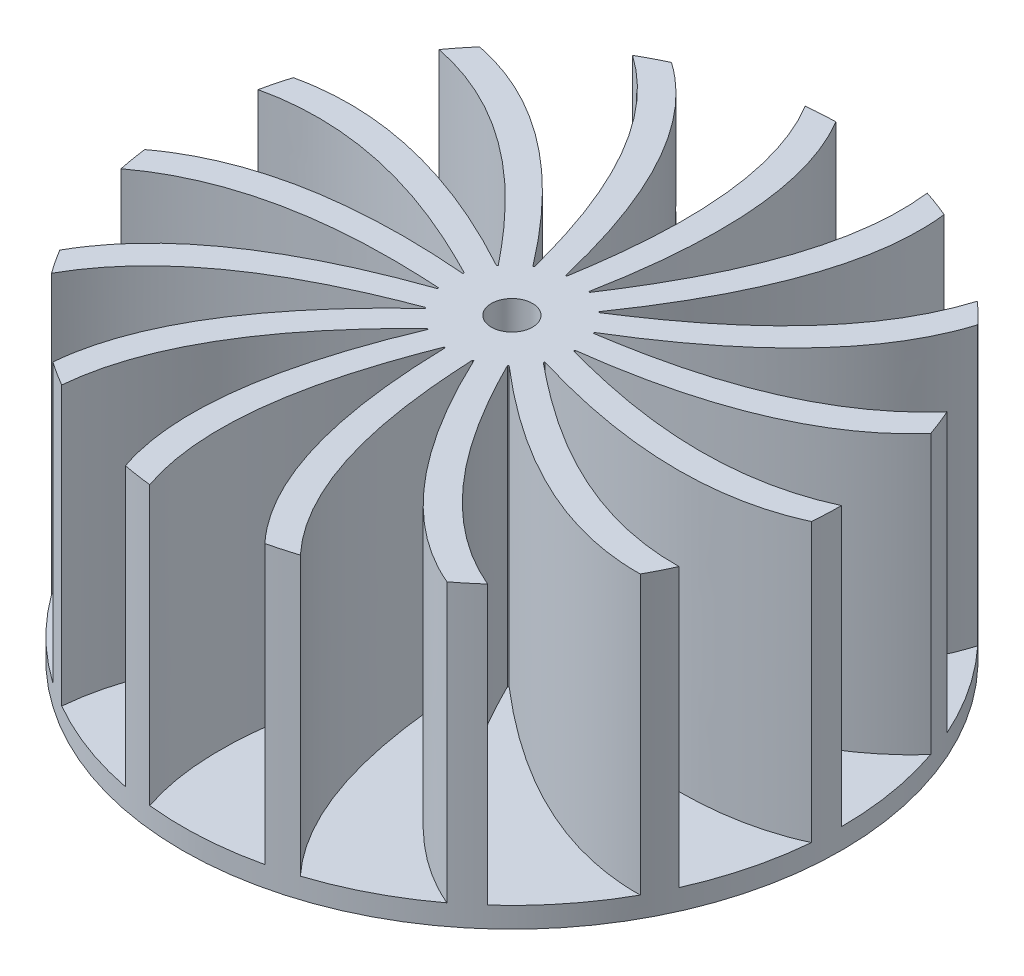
SolidWorks part; units mm, degrees
ref_plane "Front Plane" through (0, 0, 0) normal (0, 0, 1) x (1, 0, 0)
ref_plane "Top Plane" through (0, 0, 0) normal (0, 1, 0) x (1, 0, 0)
ref_plane "Right Plane" through (0, 0, 0) normal (1, 0, 0) x (0, 0, -1)
sketch "Sketch1" plane through (0, 0, 0) normal (0, 1, 0) x (1, 0, 0)
  circle A0 centre (0, 0) radius 16
  dimension "D1" = 32
extrude "Boss-Extrude1" add sketch "Sketch1" along normal blind 1
sketch "Sketch2" plane through (0, 1, 0) normal (0, 1, 0) x (1, 0, 0)
  circle A0 centre (0, 0) radius 3
  circle A1 centre (0, 0) radius 1.5
  dimension "D1" = 6
  dimension "D2" = 3
extrude "Boss-Extrude2" add sketch "Sketch2" along normal blind 13.5 contours A0
sketch "Sketch4" plane through (0, 1, 0) normal (0, 1, 0) x (1, 0, 0)
  line L0 (-0.55, 0) -> (0.55, 0) construction
  line L1 (19.6058, 1.6753) -> (12.3942, -1.6753) construction
  line L2 (19.856, 0.4207) -> (12.0572, -3.2028) construction
  circle A0 centre (0, 0) radius 3 construction
  circle A1 centre (0, 0) radius 3 construction
  circle A2 centre (0, 0) radius 16 construction
  arc A3 (16, 0) -> (15.9387, -1.3994) centre (0, 0) cw
  arc A4 (2.7645, -1.165) -> (3, 0) centre (0, 0) ccw
  arc A5 (2.0517, -2.1888) -> (2.7406, -1.2202) centre (0, 0) ccw
  arc A6 (14.6167, -6.5078) -> (13.9915, -7.7613) centre (0, 0) cw
  arc A7 (0.984, -2.834) -> (2.0074, -2.2294) centre (0, 0) ccw
  arc A8 (10.7061, -11.8903) -> (9.6251, -12.7811) centre (0, 0) cw
  arc A9 (-0.2537, -2.9893) -> (0.9271, -2.8532) centre (0, 0) ccw
  arc A10 (4.9443, -15.2169) -> (3.5944, -15.591) centre (0, 0) cw
  arc A11 (-1.4476, -2.6276) -> (-0.3136, -2.9836) centre (0, 0) ccw
  arc A12 (-1.6725, -15.9124) -> (-3.0578, -15.7051) centre (0, 0) cw
  arc A13 (-2.3912, -1.8116) -> (-1.5, -2.5981) centre (0, 0) ccw
  arc A14 (-8, -13.8564) -> (-9.1813, -13.1036) centre (0, 0) cw
  arc A15 (-2.9214, -0.6824) -> (-2.4271, -1.7634) centre (0, 0) ccw
  arc A16 (-12.9443, -9.4046) -> (-13.7172, -8.2364) centre (0, 0) cw
  arc A17 (-2.9464, 0.5648) -> (-2.9344, -0.6237) centre (0, 0) ccw
  arc A18 (-15.6504, -3.3266) -> (-15.8813, -1.945) centre (0, 0) cw
  arc A19 (-2.4619, 1.7144) -> (-2.9344, 0.6237) centre (0, 0) ccw
  arc A20 (-15.6504, 3.3266) -> (-15.2994, 4.6827) centre (0, 0) cw
  arc A21 (-1.5518, 2.5675) -> (-2.4271, 1.7634) centre (0, 0) ccw
  arc A22 (-12.9443, 9.4046) -> (-12.0721, 10.5007) centre (0, 0) cw
  arc A23 (-0.3733, 2.9767) -> (-1.5, 2.5981) centre (0, 0) ccw
  arc A24 (-8, 13.8564) -> (-6.7574, 14.503) centre (0, 0) cw
  arc A25 (0.8697, 2.8712) -> (-0.3136, 2.9836) centre (0, 0) ccw
  arc A26 (-1.6725, 15.9124) -> (-0.2743, 15.9976) centre (0, 0) cw
  arc A27 (1.9623, 2.2692) -> (0.9271, 2.8532) centre (0, 0) ccw
  arc A28 (4.9443, 15.2169) -> (6.2562, 14.7262) centre (0, 0) cw
  arc A29 (2.7156, 1.2749) -> (2.0074, 2.2294) centre (0, 0) ccw
  arc A30 (10.7061, 11.8903) -> (11.705, 10.9084) centre (0, 0) cw
  arc A31 (2.9994, 0.0601) -> (2.7406, 1.2202) centre (0, 0) ccw
  arc A32 (14.6167, 6.5078) -> (15.1299, 5.2044) centre (0, 0) cw
  spline S0 degree 3 poles (3, 0) (6.0429, -0.8283) (11.4927, -2.0942) (16, 0) knots 0 0 0 0 1 1 1 1
  spline S1 degree 2 poles (2.7645, -1.165) (11.0644, -3.664) (15.9387, -1.3994) knots 0 0 0 1 1 1
  spline S2 degree 3 poles (2.7406, -1.2202) (5.1835, -3.2146) (9.6473, -6.5876) (14.6167, -6.5078) knots 0 0 0 0 1 1 1 1
  spline S3 degree 2 poles (2.0517, -2.1888) (8.6176, -7.8476) (13.9915, -7.7613) knots 0 0 0 1 1 1
  spline S4 degree 3 poles (2.0074, -2.2294) (3.4279, -5.045) (6.1339, -9.942) (10.7061, -11.8903) knots 0 0 0 0 1 1 1 1
  spline S5 degree 2 poles (0.984, -2.834) (4.6806, -10.6742) (9.6251, -12.7811) knots 0 0 0 1 1 1
  spline S6 degree 3 poles (0.9271, -2.8532) (1.0796, -6.0031) (1.5598, -11.5773) (4.9443, -15.2169) knots 0 0 0 0 1 1 1 1
  spline S7 degree 2 poles (-0.2537, -2.9893) (-0.0656, -11.6552) (3.5944, -15.591) knots 0 0 0 1 1 1
  spline S8 degree 3 poles (-0.3136, -2.9836) (-1.4554, -5.9232) (-3.284, -11.2108) (-1.6725, -15.9124) knots 0 0 0 0 1 1 1 1
  spline S9 degree 2 poles (-1.4476, -2.6276) (-4.8005, -10.6208) (-3.0578, -15.7051) knots 0 0 0 1 1 1
  spline S10 degree 3 poles (-1.5, -2.5981) (-3.7388, -4.8191) (-7.56, -8.9059) (-8, -13.8564) knots 0 0 0 0 1 1 1 1
  spline S11 degree 2 poles (-2.3912, -1.8116) (-8.7054, -7.7501) (-9.1813, -13.1036) knots 0 0 0 1 1 1
  spline S12 degree 3 poles (-2.4271, -1.7634) (-5.3756, -2.8818) (-10.5287, -5.061) (-12.9443, -9.4046) knots 0 0 0 0 1 1 1 1
  spline S13 degree 2 poles (-2.9214, -0.6824) (-11.105, -3.5392) (-13.7172, -8.2364) knots 0 0 0 1 1 1
  spline S14 degree 3 poles (-2.9344, -0.6237) (-6.083, -0.4462) (-11.677, -0.3411) (-15.6504, -3.3266) knots 0 0 0 0 1 1 1 1
  spline S15 degree 2 poles (-2.9464, 0.5648) (-11.5845, 1.2836) (-15.8813, -1.945) knots 0 0 0 1 1 1
  spline S16 degree 3 poles (-2.9344, 0.6237) (-5.7386, 2.0666) (-10.8062, 4.4379) (-15.6504, 3.3266) knots 0 0 0 0 1 1 1 1
  spline S17 degree 2 poles (-2.4619, 1.7144) (-10.0609, 5.8844) (-15.2994, 4.6827) knots 0 0 0 1 1 1
  spline S18 degree 3 poles (-2.4271, 1.7634) (-4.4019, 4.222) (-8.0669, 8.4495) (-12.9443, 9.4046) knots 0 0 0 0 1 1 1 1
  spline S19 degree 2 poles (-1.5518, 2.5675) (-6.7976, 9.4678) (-12.0721, 10.5007) knots 0 0 0 1 1 1
  spline S20 degree 3 poles (-1.5, 2.5981) (-2.3041, 5.6474) (-3.9328, 11.0001) (-8, 13.8564) knots 0 0 0 0 1 1 1 1
  spline S21 degree 2 poles (-0.3733, 2.9767) (-2.3591, 11.4141) (-6.7574, 14.503) knots 0 0 0 1 1 1
  spline S22 degree 3 poles (-0.3136, 2.9836) (0.1921, 6.0963) (0.8814, 11.6486) (-1.6725, 15.9124) knots 0 0 0 0 1 1 1 1
  spline S23 degree 2 poles (0.8697, 2.8712) (2.4874, 11.3868) (-0.2743, 15.9976) knots 0 0 0 1 1 1
  spline S24 degree 3 poles (0.9271, 2.8532) (2.6551, 5.4911) (5.5431, 10.2831) (4.9443, 15.2169) knots 0 0 0 0 1 1 1 1
  spline S25 degree 2 poles (1.9623, 2.2692) (6.9038, 9.3907) (6.2562, 14.7262) knots 0 0 0 1 1 1
  spline S26 degree 3 poles (2.0074, 2.2294) (4.659, 3.9365) (9.2464, 7.1395) (10.7061, 11.8903) knots 0 0 0 0 1 1 1 1
  spline S27 degree 2 poles (2.7156, 1.2749) (10.1265, 5.7708) (11.705, 10.9084) knots 0 0 0 1 1 1
  spline S28 degree 3 poles (2.7406, 1.2202) (5.8573, 1.7011) (11.3509, 2.7614) (14.6167, 6.5078) knots 0 0 0 0 1 1 1 1
  spline S29 degree 2 poles (2.9994, 0.0601) (11.5982, 1.153) (15.1299, 5.2044) knots 0 0 0 1 1 1
  point P76 (0, 0)
  dimension "D1" = 15
extrude "Boss-Extrude3" add sketch "Sketch4" along normal blind 13.5
sketch "Sketch5" plane through (0, 0, 0) normal (0, -1, 0) x (1, 0, 0)
  circle A0 centre (0, 0) radius 1
  dimension "D1" = 2
extrude "Cut-Extrude1" cut sketch "Sketch5" against normal through all both and the other way through all
